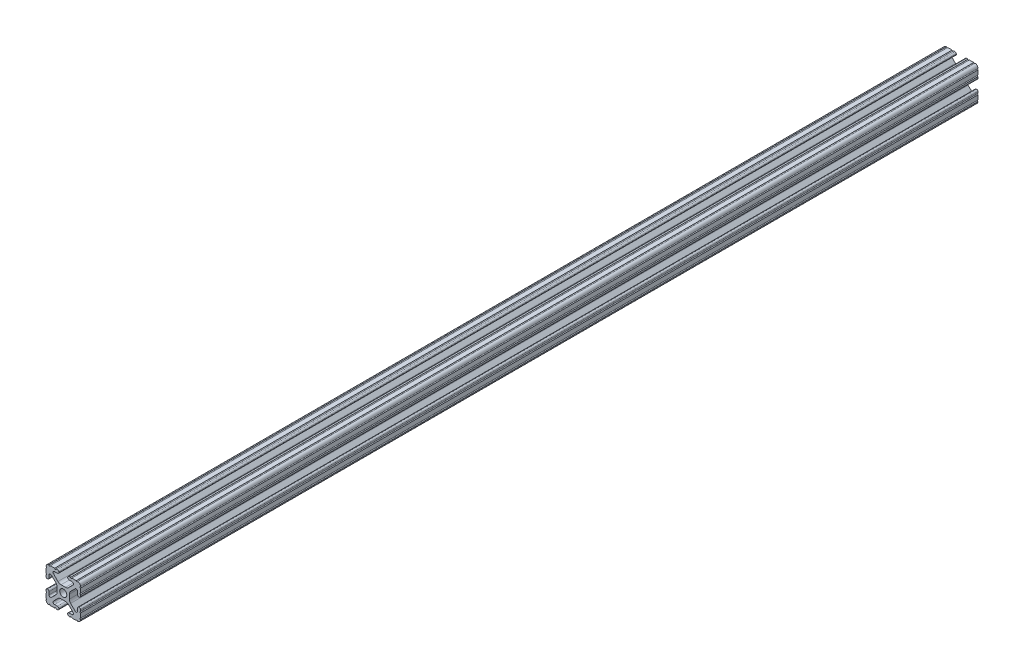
SolidWorks part; units mm, degrees
ref_plane "Front Plane" through (0, 0, 0) normal (0, 0, 1) x (1, 0, 0)
ref_plane "Top Plane" through (0, 0, 0) normal (0, 1, 0) x (1, 0, 0)
ref_plane "Right Plane" through (0, 0, 0) normal (1, 0, 0) x (0, 0, -1)
sketch "Sketch1" plane through (0, 0, 0) normal (0, 0, 1) x (1, 0, 0)
  line L0 (-7.207, 8.7244) -> (-3.8983, 5.4232)
  line L1 (-4.2875, 10.4902) -> (-6.4768, 10.4902)
  line L2 (-3.2385, 11.651) -> (-3.2385, 11.5392)
  line L3 (-5.3171, 12.7) -> (-4.2875, 12.7)
  line L4 (0, 13.4005) -> (0, -14.8534) construction
  line L5 (12.7, 0) -> (-13.9989, 0) construction
  line L6 (-9.5504, 12.7) -> (-6.3331, 12.7)
  line L7 (-12.7, 6.3331) -> (-12.7, 9.5504)
  line L8 (-12.7, 4.2875) -> (-12.7, 5.3171)
  line L9 (-11.5392, 3.2385) -> (-11.651, 3.2385)
  line L10 (-10.4902, 6.4021) -> (-10.4902, 4.2875)
  line L11 (-5.441, 3.8408) -> (-8.7371, 7.1294)
  line L12 (-4.5085, -1.5932) -> (-4.5085, 1.5932)
  line L13 (-1.7093, -4.4958) -> (1.7093, -4.4958)
  line L14 (3.9523, -5.4237) -> (7.1797, -8.6452)
  line L15 (6.4164, -10.4902) -> (4.2875, -10.4902)
  line L16 (3.2385, -11.5392) -> (3.2385, -11.651)
  line L17 (4.2875, -12.7) -> (5.3171, -12.7)
  line L18 (6.3331, -12.7) -> (9.5504, -12.7)
  line L19 (12.7, -9.5504) -> (12.7, -6.3331)
  line L20 (12.7, -5.3171) -> (12.7, -4.2875)
  line L21 (11.651, -3.2385) -> (11.5392, -3.2385)
  line L22 (10.4902, -4.2875) -> (10.4902, -6.4021)
  line L23 (8.7371, -7.1294) -> (5.441, -3.8408)
  line L24 (4.5085, -1.5932) -> (4.5085, 1.5932)
  line L25 (5.441, 3.8408) -> (8.7371, 7.1294)
  line L26 (10.4902, 6.4021) -> (10.4902, 4.2875)
  line L27 (11.5392, 3.2385) -> (11.651, 3.2385)
  line L28 (12.7, 4.2875) -> (12.7, 5.3171)
  line L29 (12.7, 6.3331) -> (12.7, 9.5504)
  line L30 (9.5504, 12.7) -> (6.3331, 12.7)
  line L31 (5.3171, 12.7) -> (4.2875, 12.7)
  line L32 (3.2385, 11.651) -> (3.2385, 11.5392)
  line L33 (4.2875, 10.4902) -> (6.4768, 10.4902)
  line L34 (7.207, 8.7244) -> (3.8983, 5.4232)
  line L35 (1.6558, 4.4958) -> (-1.6558, 4.4958)
  line L36 (-8.7371, -7.1294) -> (-5.441, -3.8408)
  line L37 (-10.4902, -4.2875) -> (-10.4902, -6.4021)
  line L38 (-11.651, -3.2385) -> (-11.5392, -3.2385)
  line L39 (-12.7, -5.3171) -> (-12.7, -4.2875)
  line L40 (-12.7, -9.5504) -> (-12.7, -6.3331)
  line L41 (-6.3331, -12.7) -> (-9.5504, -12.7)
  line L42 (-4.2875, -12.7) -> (-5.3171, -12.7)
  line L43 (-3.2385, -11.5392) -> (-3.2385, -11.651)
  line L44 (-6.4164, -10.4902) -> (-4.2875, -10.4902)
  line L45 (-3.9523, -5.4237) -> (-7.1797, -8.6452)
  arc A0 (-7.207, 8.7244) -> (-6.4768, 10.4902) centre (-6.4768, 9.4563) cw
  arc A1 (-3.2385, 11.5392) -> (-4.2875, 10.4902) centre (-4.2875, 11.5392) cw
  arc A2 (-4.2875, 12.7) -> (-3.2385, 11.651) centre (-4.2875, 11.651) cw
  arc A3 (-5.3171, 12.7) -> (-6.3331, 12.7) centre (-5.8251, 12.7) cw
  arc A4 (-9.5504, 12.7) -> (-10.5664, 12.6998) centre (-10.0584, 12.7) cw
  arc A5 (-12.6998, 10.5664) -> (-10.5664, 12.6998) centre (-10.5918, 10.5918) cw
  arc A6 (-12.6998, 10.5664) -> (-12.7, 9.5504) centre (-12.7, 10.0584) cw
  arc A7 (-12.7, 6.3331) -> (-12.7, 5.3171) centre (-12.7, 5.8251) cw
  arc A8 (-11.651, 3.2385) -> (-12.7, 4.2875) centre (-11.651, 4.2875) cw
  arc A9 (-10.4902, 4.2875) -> (-11.5392, 3.2385) centre (-11.5392, 4.2875) cw
  circle A10 centre (0, 0) radius 2.6035
  arc A11 (-10.4902, 6.4021) -> (-8.7371, 7.1294) centre (-9.4628, 6.4021) cw
  arc A12 (-5.441, 3.8408) -> (-4.5085, 1.5932) centre (-7.6835, 1.5932) cw
  arc A13 (-4.5085, -1.5932) -> (-5.441, -3.8408) centre (-7.6835, -1.5932) cw
  arc A14 (-8.7371, -7.1294) -> (-10.4902, -6.4021) centre (-9.4628, -6.4021) cw
  arc A15 (-1.7093, -4.4958) -> (-3.9523, -5.4237) centre (-1.7093, -7.6708) ccw
  arc A16 (3.9523, -5.4237) -> (1.7093, -4.4958) centre (1.7093, -7.6708) ccw
  arc A17 (6.4164, -10.4902) -> (7.1797, -8.6452) centre (6.4164, -9.4098) ccw
  arc A18 (4.2875, -10.4902) -> (3.2385, -11.5392) centre (4.2875, -11.5392) ccw
  arc A19 (3.2385, -11.651) -> (4.2875, -12.7) centre (4.2875, -11.651) ccw
  arc A20 (6.3331, -12.7) -> (5.3171, -12.7) centre (5.8251, -12.7) ccw
  arc A21 (10.5664, -12.6998) -> (9.5504, -12.7) centre (10.0584, -12.7) ccw
  arc A22 (10.5664, -12.6998) -> (12.6998, -10.5664) centre (10.5918, -10.5918) ccw
  arc A23 (12.7, -9.5504) -> (12.6998, -10.5664) centre (12.7, -10.0584) ccw
  arc A24 (12.7, -5.3171) -> (12.7, -6.3331) centre (12.7, -5.8251) ccw
  arc A25 (12.7, -4.2875) -> (11.651, -3.2385) centre (11.651, -4.2875) ccw
  arc A26 (11.5392, -3.2385) -> (10.4902, -4.2875) centre (11.5392, -4.2875) ccw
  arc A27 (8.7371, -7.1294) -> (10.4902, -6.4021) centre (9.4628, -6.4021) ccw
  arc A28 (4.5085, -1.5932) -> (5.441, -3.8408) centre (7.6835, -1.5932) ccw
  arc A29 (5.441, 3.8408) -> (4.5085, 1.5932) centre (7.6835, 1.5932) ccw
  arc A30 (10.4902, 6.4021) -> (8.7371, 7.1294) centre (9.4628, 6.4021) ccw
  arc A31 (10.4902, 4.2875) -> (11.5392, 3.2385) centre (11.5392, 4.2875) ccw
  arc A32 (11.651, 3.2385) -> (12.7, 4.2875) centre (11.651, 4.2875) ccw
  arc A33 (12.7, 6.3331) -> (12.7, 5.3171) centre (12.7, 5.8251) ccw
  arc A34 (12.6998, 10.5664) -> (12.7, 9.5504) centre (12.7, 10.0584) ccw
  arc A35 (12.6998, 10.5664) -> (10.5664, 12.6998) centre (10.5918, 10.5918) ccw
  arc A36 (9.5504, 12.7) -> (10.5664, 12.6998) centre (10.0584, 12.7) ccw
  arc A37 (5.3171, 12.7) -> (6.3331, 12.7) centre (5.8251, 12.7) ccw
  arc A38 (4.2875, 12.7) -> (3.2385, 11.651) centre (4.2875, 11.651) ccw
  arc A39 (3.2385, 11.5392) -> (4.2875, 10.4902) centre (4.2875, 11.5392) ccw
  arc A40 (7.207, 8.7244) -> (6.4768, 10.4902) centre (6.4768, 9.4563) ccw
  arc A41 (1.6558, 4.4958) -> (3.8983, 5.4232) centre (1.6558, 7.6708) ccw
  arc A42 (-1.6558, 4.4958) -> (-3.8983, 5.4232) centre (-1.6558, 7.6708) cw
  arc A43 (-11.5392, -3.2385) -> (-10.4902, -4.2875) centre (-11.5392, -4.2875) cw
  arc A44 (-12.7, -4.2875) -> (-11.651, -3.2385) centre (-11.651, -4.2875) cw
  arc A45 (-12.7, -5.3171) -> (-12.7, -6.3331) centre (-12.7, -5.8251) cw
  arc A46 (-12.7, -9.5504) -> (-12.6998, -10.5664) centre (-12.7, -10.0584) cw
  arc A47 (-10.5664, -12.6998) -> (-12.6998, -10.5664) centre (-10.5918, -10.5918) cw
  arc A48 (-10.5664, -12.6998) -> (-9.5504, -12.7) centre (-10.0584, -12.7) cw
  arc A49 (-6.3331, -12.7) -> (-5.3171, -12.7) centre (-5.8251, -12.7) cw
  arc A50 (-3.2385, -11.651) -> (-4.2875, -12.7) centre (-4.2875, -11.651) cw
  arc A51 (-4.2875, -10.4902) -> (-3.2385, -11.5392) centre (-4.2875, -11.5392) cw
  arc A52 (-6.4164, -10.4902) -> (-7.1797, -8.6452) centre (-6.4164, -9.4098) cw
  dimension "D1" = 5.207
  dimension "D9" = 14.859
  dimension "D2" = 25.4
  dimension "D3" = 12.7
  dimension "D4" = 6.477
  dimension "D5" = 8.2042
  dimension "D6" = 9.017
  dimension "D8" = 2.2098
  dimension "D10" = 2.2098
extrude "Extrude1" add sketch "Sketch1" against normal blind 660.4
